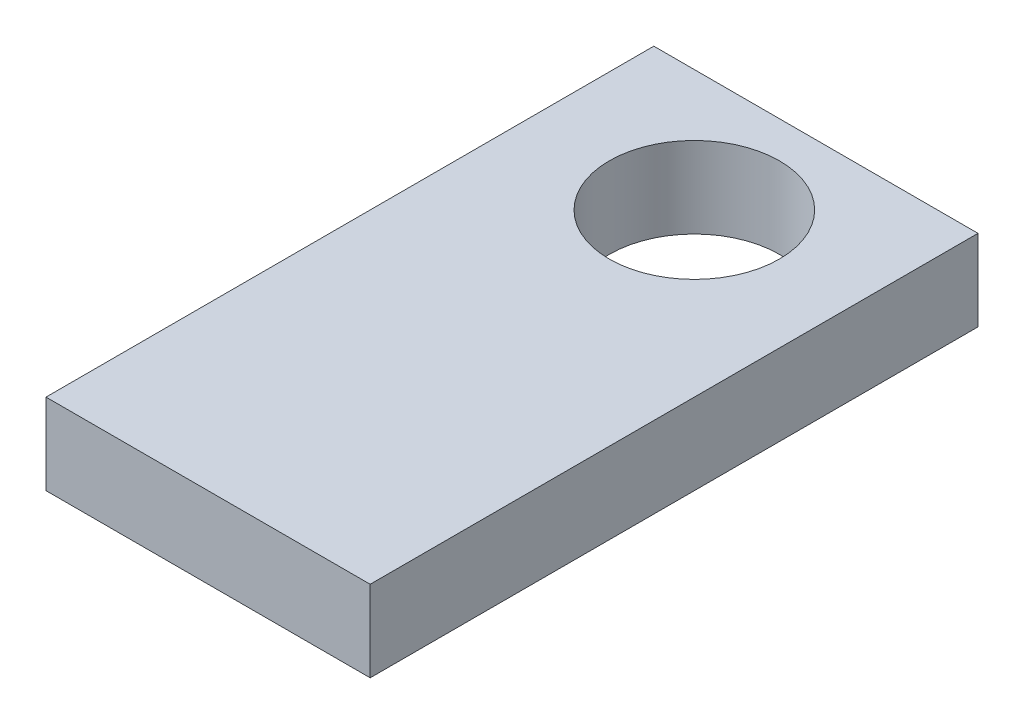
SolidWorks part; units mm, degrees
ref_plane "Face" through (0, 0, 0) normal (0, 0, 1) x (1, 0, 0)
ref_plane "Dessus" through (0, 0, 0) normal (0, 1, 0) x (1, 0, 0)
ref_plane "Droite" through (0, 0, 0) normal (1, 0, 0) x (0, 0, -1)
sketch "Esquisse1" plane through (0, 0, 0) normal (0, 0, 1) x (1, 0, 0)
  line L1 (0, 0) -> (80, 0)
  line L2 (0, 0) -> (0, 20)
  line L3 (0, 20) -> (80, 20)
  line L4 (80, 0) -> (80, 20)
  dimension "D1" = 80
  dimension "D2" = 20
extrude "Base-Extrusion" add sketch "Esquisse1" along normal blind 150
sketch "Esquisse2" plane through (0, 20, 0) normal (0, 1, 0) x (-1, 0, 0)
  line L0 (-40, 0) -> (-40, 139.5426) construction
  line L1 (-80, 0) -> (0, 0) construction
  line L2 (-80, 150) -> (0, 150) construction
  circle A0 centre (-40, 30) radius 21
  dimension "D1" = 42
  dimension "D2" = 120
extrude "Enlèv. mat.-Extru.1" cut sketch "Esquisse2" against normal through all
